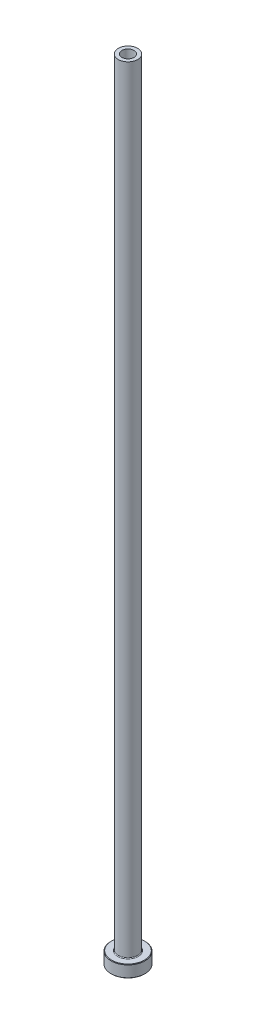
SolidWorks part; units mm, degrees
ref_plane "Front Plane" through (0, 0, 0) normal (0, 0, 1) x (1, 0, 0)
ref_plane "Top Plane" through (0, 0, 0) normal (0, 1, 0) x (1, 0, 0)
ref_plane "Right Plane" through (0, 0, 0) normal (1, 0, 0) x (0, 0, -1)
sketch "Sketch1" plane through (0, 0, 0) normal (0, 0, 1) x (1, 0, 0)
  line L0 (-2.5, 325) -> (-4, 325)
  line L1 (-4, 325) -> (-4, 5)
  line L2 (-4, 5) -> (-7, 5)
  line L3 (-7, 5) -> (-7, 0)
  line L4 (7.7, 0) -> (-7.7, 0) construction
  line L5 (-7, 0) -> (-2.75, 0)
  line L6 (-2.5, 280) -> (-2.5, 325)
  line L7 (0, 92.1877) -> (0, -15.5353) construction
  line L8 (0, -7.7) -> (0, 7.7) construction
  line L9 (-2.5, 280) -> (-2.75, 268)
  line L10 (-2.75, 268) -> (-2.75, 0)
  dimension "D1" = 0.25
  dimension "ID" = 5
  dimension "OD" = 8
  dimension "L" = 325
  dimension "H" = 14
  dimension "T" = 5
  dimension "N" = 45
  dimension "D2" = 12
revolve "Revolve1" add sketch "Sketch1" angle 360 about L7
fillet "Fillet1" radius 0.3 1 edges at (0, 5, 4)
chamfer "Chamfer1" distance 0.2 angle 45 2 edges at (0, 5, 7) (0, 0, 7)
chamfer "Chamfer3" distance 0.5 angle 45 1 edges at (0, 0, 2.75)
